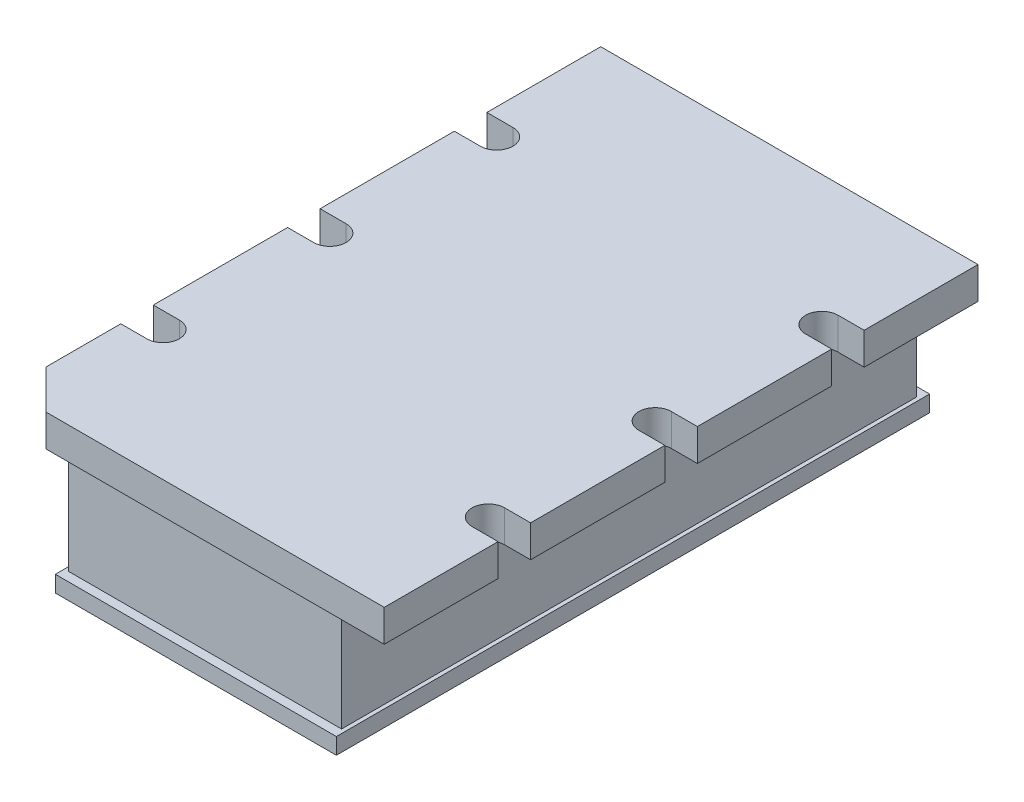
SolidWorks part; units mm, degrees
ref_plane "Front Plane" through (0, 0, 0) normal (0, 0, 1) x (1, 0, 0)
ref_plane "Top Plane" through (0, 0, 0) normal (0, 1, 0) x (1, 0, 0)
ref_plane "Right Plane" through (0, 0, 0) normal (1, 0, 0) x (0, 0, -1)
sketch "Sketch1" plane through (0, 0, 0) normal (0, 1, 0) x (1, 0, 0)
  line L1 (-18.415, 28.9814) -> (18.415, 28.9814)
  line L2 (-18.415, 28.9814) -> (-18.415, -28.9814)
  line L3 (-18.415, -28.9814) -> (18.415, -28.9814)
  line L4 (18.415, 28.9814) -> (18.415, -28.9814)
  dimension "D1" = 36.83
  dimension "D2" = 57.9628
  dimension "D3" = 28.9814
  dimension "D4" = 18.415
extrude "Extrude1" add sketch "Sketch1" along normal blind 3.1242
sketch "Sketch2" plane through (0, 0, 0) normal (0, -1, 0) x (1, 0, 0)
  line L0 (-18.415, -28.9814) -> (-18.415, 28.9814) construction
  line L1 (-15.875, 17.8689) -> (-18.415, 17.8689)
  line L2 (-15.875, 14.6939) -> (-18.415, 14.6939)
  line L3 (-18.415, 14.6939) -> (-18.415, 17.8689)
  line L4 (-18.415, 17.8689) -> (-18.502, 17.9507)
  line L5 (-18.415, 28.9814) -> (18.415, 28.9814) construction
  line L6 (-15.875, 1.5875) -> (-18.415, 1.5875)
  line L7 (-18.415, 1.5875) -> (-18.415, -1.5875)
  line L8 (-18.415, -1.5875) -> (-15.875, -1.5875)
  arc A0 (-15.875, 14.6939) -> (-15.875, 17.8689) centre (-15.875, 16.2814) ccw
  arc A1 (-15.875, -1.5875) -> (-15.875, 1.5875) centre (-15.875, 0) ccw
  dimension "D1" = 2.54
  dimension "D2" = 12.7
  dimension "D3" = 3.175
extrude "Extrude2" cut sketch "Sketch2" against normal through all contours L2 A0 L1 M1 | L8 A1 L6 M1
mirror "Mirror1" about plane through (0, 0, 0) normal (0, 0, 1) of "Extrude2"
mirror "Mirror2" about plane through (0, 0, 0) normal (1, 0, 0) of "Mirror1", "Extrude2"
chamfer "Chamfer1" distance 3.81 angle 45 1 edges at (-18.415, 1.5621, 28.9814)
sketch "Sketch4" plane through (0, 0, 0) normal (0, -1, 0) x (1, 0, 0)
  line L1 (-13.335, 28.067) -> (13.335, 28.067)
  line L2 (-13.335, 28.067) -> (-13.335, -28.067)
  line L3 (-13.335, -28.067) -> (13.335, -28.067)
  line L4 (13.335, 28.067) -> (13.335, -28.067)
  dimension "D1" = 26.67
  dimension "D2" = 56.134
  dimension "D3" = 28.067
  dimension "D4" = 13.335
extrude "Extrude4" add sketch "Sketch4" along normal blind 10.16
sketch "Sketch3" plane through (0, -10.16, 0) normal (0, -1, 0) x (1, 0, 0)
  line L0 (-13.716, 13.716) -> (-18.6436, 13.716)
  line L1 (-13.716, 28.956) -> (13.716, 28.956)
  line L2 (-13.716, 28.956) -> (-13.716, 13.716)
  line L3 (-13.716, -28.956) -> (13.716, -28.956)
  line L4 (13.716, 28.956) -> (13.716, -28.956)
  line L5 (-18.6436, 13.716) -> (-18.6436, -13.716)
  line L6 (-18.6436, -13.716) -> (-13.716, -13.716)
  line L7 (-13.716, -13.716) -> (-13.716, -28.956)
  dimension "D1" = 27.432
  dimension "D2" = 57.912
  dimension "D3" = 28.956
  dimension "D4" = 13.716
  dimension "D5" = 4.9276
  dimension "D6" = 27.432
  dimension "D7" = 13.716
extrude "Extrude5" add sketch "Sketch3" along normal blind 1.5875
sketch "Sketch6" plane through (0, 0, -13.716) normal (0, 0, -1) x (-1, 0, 0)
  line L0 (18.796, -11.7475) -> (18.796, -17.5895)
  line L1 (18.796, -17.5895) -> (18.3844, -17.5895)
  line L2 (16.9401, -20.2565) -> (13.3841, -20.2565)
  line L3 (13.3841, -20.2565) -> (12.7, -14.7193)
  line L4 (12.7, -14.7193) -> (12.7, -11.7475)
  line L5 (18.6436, -11.7475) -> (13.716, -11.7475) construction
  line L6 (12.7, -11.7475) -> (18.796, -11.7475)
  line L7 (13.716, -11.7475) -> (13.716, -10.16) construction
  line L8 (18.3844, -17.5895) -> (16.9401, -20.2565)
  dimension "D1" = 6.096
  dimension "D2" = 5.08
  dimension "D3" = 8.509
  dimension "D4" = 5.842
  dimension "D5" = 2.9718
extrude "Extrude6" add sketch "Sketch6" against normal blind 26.67
